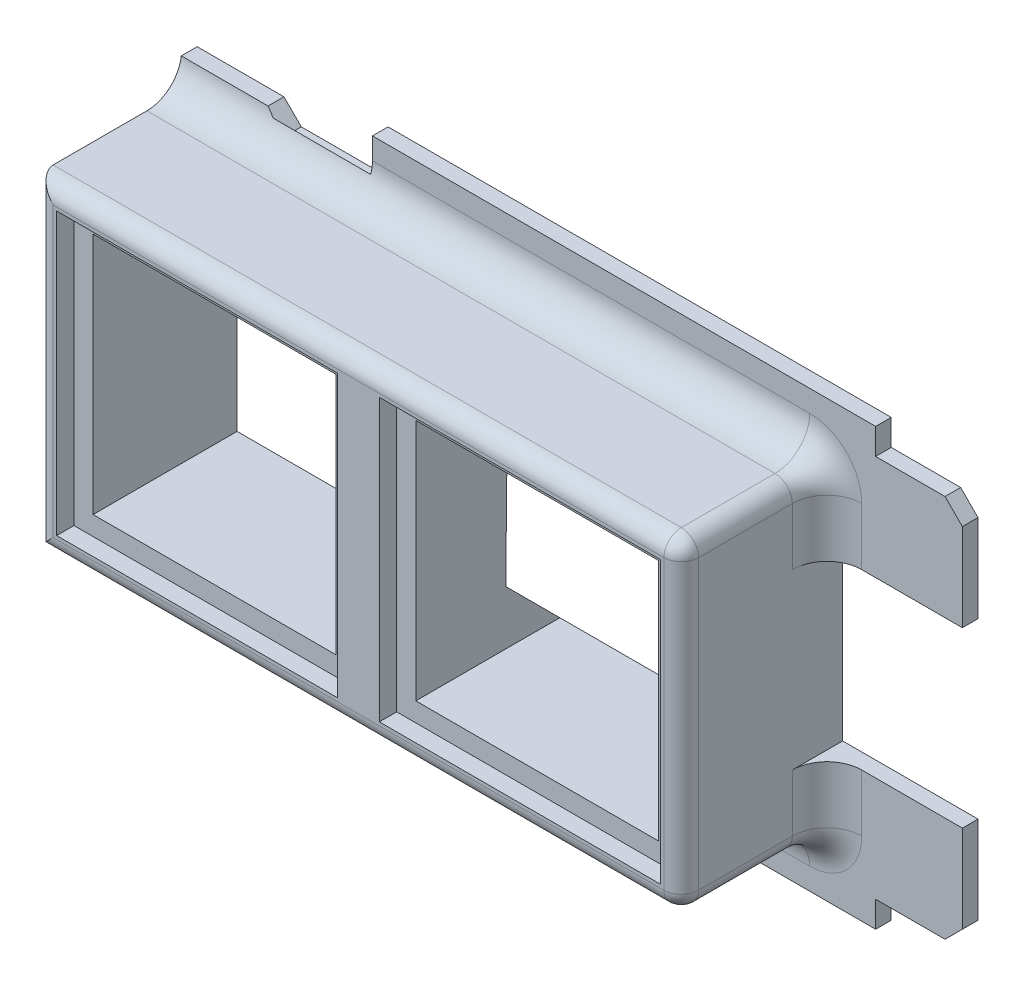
SolidWorks part; units mm, degrees
ref_plane "Bottom Plane" through (0, 0, 0) normal (0, 0, 1) x (1, 0, 0)
ref_plane "Front Plane" through (0, 0, 0) normal (0, 1, 0) x (1, 0, 0)
ref_plane "Left Plane" through (0, 0, 0) normal (1, 0, 0) x (0, 0, -1)
sketch "Sketch1" plane through (0, 0, 0) normal (0, 0, 1) x (1, 0, 0)
  line L1 (-18.6, -9.3) -> (18.6, -9.3)
  line L2 (-18.6, -9.3) -> (-18.6, 9.3)
  line L3 (-18.6, 9.3) -> (18.6, 9.3)
  line L4 (18.6, -9.3) -> (18.6, 9.3)
  line L5 (-18.6, -9.3) -> (18.6, 9.3) construction
  line L6 (-18.6, 9.3) -> (18.6, -9.3) construction
  line L7 (-16.3, -7) -> (-2.3, -7)
  line L8 (-16.3, -7) -> (-16.3, 7)
  line L9 (-16.3, 7) -> (-2.3, 7)
  line L10 (-2.3, -7) -> (-2.3, 7)
  line L11 (2.3, 7) -> (16.3, 7)
  line L12 (2.3, 7) -> (2.3, -7)
  line L13 (2.3, -7) -> (16.3, -7)
  line L14 (16.3, 7) -> (16.3, -7)
  point P0 (0, 0)
  dimension "D1" = 14
  dimension "D2" = 14
  dimension "D3" = 14
  dimension "D4" = 14
  dimension "D5" = 2.3
  dimension "D6" = 4.6
  dimension "D7" = 2.3
  dimension "D8" = 2.3
  dimension "D9" = 2.3
  dimension "D10" = 2.3
extrude "Boss-Extrude1" add sketch "Sketch1" along normal blind 9.3
sketch "Sketch2" plane through (0, 0, 9.3) normal (0, 0, 1) x (1, 0, 0)
  line L0 (-2.3, 7) -> (-16.3, 7) construction
  line L1 (-17.4, -8.1) -> (-1.2, -8.1)
  line L2 (-17.4, -8.1) -> (-17.4, 8.1)
  line L3 (-17.4, 8.1) -> (-1.2, 8.1)
  line L4 (-1.2, -8.1) -> (-1.2, 8.1)
  line L5 (1.2, 8.1) -> (17.4, 8.1)
  line L6 (1.2, 8.1) -> (1.2, -8.1)
  line L7 (1.2, -8.1) -> (17.4, -8.1)
  line L8 (17.4, 8.1) -> (17.4, -8.1)
  line L9 (-16.3, -7) -> (-2.3, -7) construction
  line L10 (-16.3, 7) -> (-16.3, -7) construction
  line L11 (-2.3, -7) -> (-2.3, 7) construction
  line L12 (2.3, 7) -> (2.3, -7) construction
  line L13 (16.3, 7) -> (2.3, 7) construction
  line L14 (2.3, -7) -> (16.3, -7) construction
  line L15 (16.3, -7) -> (16.3, 7) construction
  dimension "D1" = 1.1
  dimension "D2" = 1.1
  dimension "D3" = 1.1
  dimension "D4" = 1.1
  dimension "D5" = 1.1
  dimension "D6" = 1.1
  dimension "D7" = 1.1
  dimension "D8" = 1.1
extrude "Cut-Extrude1" cut sketch "Sketch2" against normal blind 1
sketch "Sketch4" plane through (0, 0, 0) normal (0, 0, -1) x (-1, 0, 0)
  line L0 (-18.6, 12.55) -> (-26.4, 12.55)
  line L1 (18.6, 12.55) -> (-18.6, 12.55)
  line L2 (18.6, 12.55) -> (18.6, -12.55)
  line L3 (18.6, -12.55) -> (-18.6, -12.55)
  line L4 (-18.6, 12.55) -> (-18.6, -12.55)
  line L5 (-18.6, -9.3) -> (18.6, -9.3)
  line L6 (-18.6, -9.3) -> (-18.6, 9.3)
  line L7 (-18.6, 9.3) -> (18.6, 9.3)
  line L8 (18.6, -9.3) -> (18.6, 9.3)
  line L9 (-26.4, 12.55) -> (-26.4, 5)
  line L10 (-26.4, 5) -> (-18.6, 5)
  line L11 (-18.6, 5) -> (-18.6, -5)
  line L12 (-18.6, -5) -> (-26.4, -5)
  line L13 (-26.4, -5) -> (-26.4, -12.55)
  line L14 (-26.4, -12.55) -> (-18.6, -12.55)
  point P4 (18.6, 0)
  dimension "D1" = 25.1
  dimension "D2" = 7.55
  dimension "D3" = 7.55
  dimension "D4" = 7.8
extrude "Boss-Extrude2" add sketch "Sketch4" against normal blind 0.9 contours L1 L4 L2 M8 | L4 L3 L2 M6 | L9 L10 L4 L0 M5 | L13 L14 L4 L12 M5
fillet "Fillet1" radius 1 6 edges at (-18.6, 0, 9.3) (0, -9.3, 9.3) (18.6, -9.3, 5.1) (18.6, 0, 9.3) (18.6, 9.3, 5.1) (0, 9.3, 9.3)
fillet "Fillet3" radius 2 6 edges at (18.6, 6.65, 0.9) (18.3071, 9.0071, 0.9) (18.6, -6.65, 0.9) (18.3071, -9.0071, 0.9) (-0.5, 9.3, 0.9) (-0.5, -9.3, 0.9)
sketch "Sketch5" plane through (0, 0, 0.9) normal (0, 0, 1) x (1, 0, 0)
  line L1 (26.4, 12.55) -> (21.4, 12.55)
  line L2 (26.4, 12.55) -> (26.4, 11.05)
  line L3 (26.4, 11.05) -> (21.4, 11.05)
  line L4 (21.4, 12.55) -> (21.4, 11.05)
  line L5 (26.4, -12.55) -> (21.4, -12.55)
  line L6 (26.4, -12.55) -> (26.4, -11.05)
  line L7 (26.4, -11.05) -> (21.4, -11.05)
  line L8 (21.4, -12.55) -> (21.4, -11.05)
  line L9 (-18.6, 12.55) -> (-13.6, 12.55)
  line L10 (-18.6, 12.55) -> (-18.6, 11.05)
  line L11 (-18.6, 11.05) -> (-13.6, 11.05)
  line L12 (-13.6, 12.55) -> (-13.6, 11.05)
  line L13 (-18.6, -12.55) -> (-13.6, -12.55)
  line L14 (-18.6, -12.55) -> (-18.6, -11.05)
  line L15 (-18.6, -11.05) -> (-13.6, -11.05)
  line L16 (-13.6, -12.55) -> (-13.6, -11.05)
  point P20 (23.9, 11.05)
  dimension "D1" = 1.5
  dimension "D2" = 1.5
  dimension "D3" = 1.5
  dimension "D4" = 1.5
  dimension "D5" = 5
  dimension "D6" = 5
  dimension "D7" = 5
  dimension "D8" = 5
extrude "Cut-Extrude2" cut sketch "Sketch5" against normal through all both and the other way through all
sketch "Sketch6" plane through (-2.3, 0, 0) normal (-1, 0, 0) x (0, 0, 1)
  line L0 (0, 7) -> (3.0339, 3.9661)
  line L1 (3.0339, 3.9661) -> (3.1164, -3.8836)
  line L2 (3.1164, -3.8836) -> (0, -7)
  line L3 (0, -7) -> (0, 7)
  dimension "D1" = 45
  dimension "D2" = 45
extrude "Cut-Extrude3" cut sketch "Sketch6" against normal up to next
sketch "Sketch8" plane through (0, 0, 0) normal (0, 0, -1) x (-1, 0, 0)
  line L1 (13.6, -12.55) -> (7.6, -12.55)
  line L2 (13.6, -12.55) -> (13.6, -10.05)
  line L3 (13.6, -10.05) -> (7.6, -10.05)
  line L4 (7.6, -12.55) -> (7.6, -10.05)
  line L7 (13.6, 12.55) -> (7.6, 12.55)
  line L8 (13.6, 12.55) -> (13.6, 10.05)
  line L9 (13.6, 10.05) -> (7.6, 10.05)
  line L10 (7.6, 12.55) -> (7.6, 10.05)
  dimension "D1" = 6
  dimension "D2" = 2.5
  dimension "D3" = 6
  dimension "D4" = 2.5
extrude "Cut-Extrude4" cut sketch "Sketch8" against normal blind 1
chamfer "Chamfer1" distance 1 angle 45 4 edges at (-13.6, -10.05, 0.5) (-13.6, 10.05, 0.5) (26.4, -11.05, 0.45) (26.4, 11.05, 0.45)
